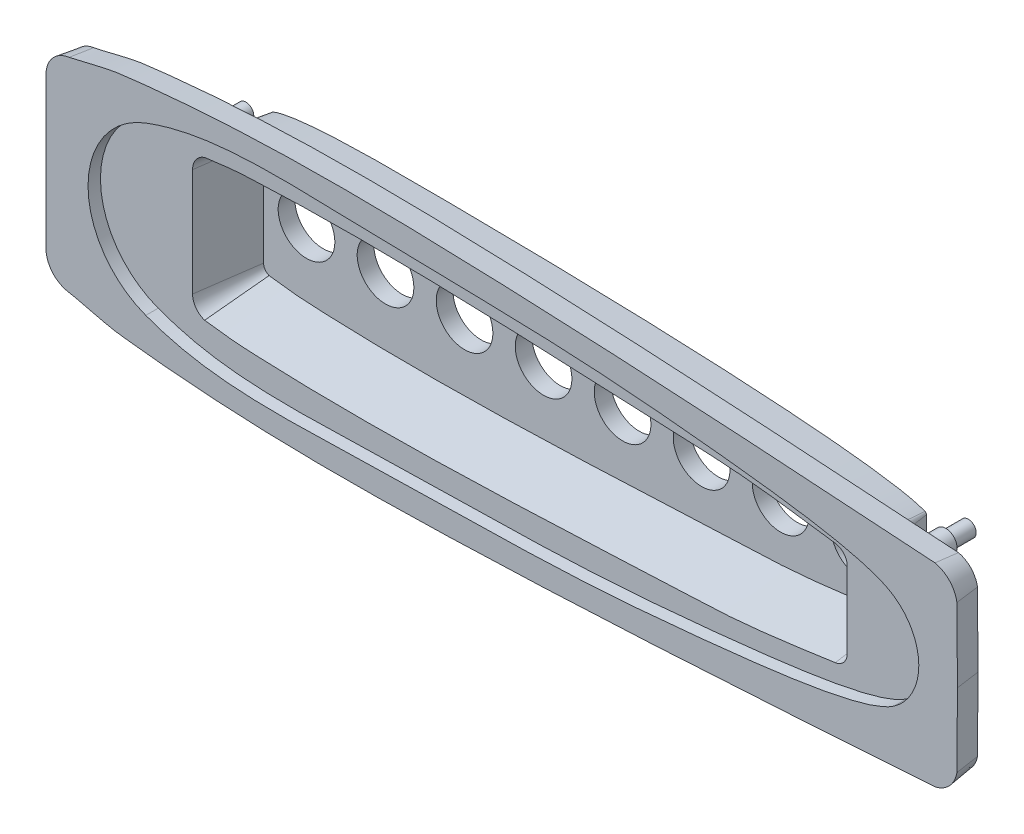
SolidWorks part; units mm, degrees
ref_plane "Plan de face" through (0, 0, 0) normal (0, 0, 1) x (1, 0, 0)
ref_plane "Plan de dessus" through (0, 0, 0) normal (0, 1, 0) x (1, 0, 0)
ref_plane "Plan de droite" through (0, 0, 0) normal (1, 0, 0) x (0, 0, -1)
sketch "Esquisse1" plane through (0, 0, 0) normal (0, 0, 1) x (1, 0, 0)
  line L0 (1.2, 0) -> (83.8076, 0) construction
  line L1 (1.2, -7) -> (1.2, 7) construction
  line L2 (81.3463, 0) -> (81.3, 6.5)
  line L3 (1.2, -6.7987) -> (1.2, 6.7987)
  line L4 (81.3463, 0) -> (81.3, -6.5)
  arc A0 (81.3, 6.5) -> (79.6134, 8.2964) centre (79.1226, 6.1457) ccw
  arc A1 (2.9981, 8.7297) -> (1.2, 6.7987) centre (3.2763, 6.668) ccw
  arc A2 (2.9981, -8.7297) -> (1.2, -6.7987) centre (3.2763, -6.668) cw
  arc A3 (81.3, -6.5) -> (79.6134, -8.2964) centre (79.1226, -6.1457) cw
  spline S0 degree 3 poles (1.6002, 8.1316) (1.6425, 8.1642) (1.6871, 8.1908) (1.7767, 8.2424) (1.8222, 8.2666) (1.9598, 8.3361) (2.053, 8.3785) (2.3351, 8.4991) (2.5266, 8.5705) (3.1064, 8.7707) (3.5007, 8.8851) (4.692, 9.1974) (5.4926, 9.3631) (7.904, 9.7971) (9.5247, 10.0003) (12.7791, 10.3205) (14.4124, 10.4343) (17.675, 10.599) (19.3063, 10.6497) (22.5693, 10.7034) (24.2008, 10.7009) (27.4639, 10.6963) (29.0955, 10.6909) (33.9903, 10.6642) (37.2535, 10.6324) (43.7801, 10.5253) (47.044, 10.4504) (53.5692, 10.2289) (56.83, 10.0818) (61.7167, 9.7726) (63.345, 9.6545) (66.5994, 9.39) (68.2254, 9.2434) (71.477, 8.945) (73.1027, 8.7945) (76.3565, 8.5219) (77.9845, 8.3999) (79.6142, 8.2964) knots 0 0 0 0 0.001953 0.001953 0.003906 0.003906 0.007813 0.007813 0.015625 0.015625 0.03125 0.03125 0.0625 0.0625 0.125 0.125 0.1875 0.1875 0.25 0.25 0.3125 0.3125 0.375 0.375 0.5 0.5 0.625 0.625 0.75 0.75 0.8125 0.8125 0.875 0.875 0.9375 0.9375 1 1 1 1 construction
  spline S1 degree 3 poles (79.6134, 8.2964) (65.4366, 9.2448) (41.3608, 10.8555) (17.7967, 10.977) (6.0247, 9.5322) (3.6821, 8.8221) (2.9981, 8.7297) knots 0 0 0 0 0.552308 0.937959 0.937959 1 1 1 1
  spline S2 degree 3 poles (79.6134, -8.2964) (65.4366, -9.2448) (41.3608, -10.8555) (17.7967, -10.977) (6.0247, -9.5322) (3.6821, -8.8221) (2.9981, -8.7297) knots 0 0 0 0 0.552308 0.937959 0.937959 1 1 1 1
extrude "Extrusion1" add sketch "Esquisse1" along normal blind 2.12 draft 8
sketch "Esquisse2" plane through (0, 0, 2.12) normal (0, 0, 1) x (1, 0, 0)
  line L0 (0, 0) -> (82.0158, 0) construction
  arc A0 (9.7406, 7.3783) -> (9.7406, -7.3783) centre (12.5055, 0) ccw
  arc A1 (76.0403, -4.2062) -> (76.0403, 4.2062) centre (73.0791, 0) ccw
  spline S0 degree 3 poles (76.0403, 4.2062) (73.7947, 5.7871) (67.2235, 6.6668) (46.2556, 8.9404) (42.0249, 8.5563) (17.5565, 9.2655) (13.5052, 8.7891) (9.7406, 7.3783) knots 0 0 0 0 0.230471 0.230471 0.77376 0.77376 1 1 1 1
  spline S1 degree 3 poles (76.0403, -4.2062) (73.7947, -5.7871) (67.2235, -6.6668) (46.2556, -8.9404) (42.0249, -8.5563) (17.5565, -9.2655) (13.5052, -8.7891) (9.7406, -7.3783) knots 0 0 0 0 0.230471 0.230471 0.77376 0.77376 1 1 1 1
extrude "Enlèv. mat.-Extru.1" cut sketch "Esquisse2" against normal blind 1.1
sketch "Esquisse3" plane through (0, 0, 1.02) normal (0, 0, 1) x (1, 0, 0)
  line L0 (0.9021, 0) -> (81.6442, 0) construction
  line L1 (0.9021, 6.8077) -> (0.9021, -6.8077) construction
  line L2 (11.783, -5.5412) -> (11.783, 5.5412)
  line L3 (71.783, -3.8004) -> (71.783, 3.8004)
  arc A0 (11.783, 5.5412) -> (12.3401, 6.5544) centre (12.983, 5.5412) cw
  arc A1 (71.783, 3.8004) -> (71.0536, 4.9043) centre (70.583, 3.8004) ccw
  arc A2 (71.783, -3.8004) -> (71.0536, -4.9043) centre (70.583, -3.8004) cw
  arc A3 (11.783, -5.5412) -> (12.3401, -6.5544) centre (12.983, -5.5412) ccw
  spline S0 degree 3 poles (71.0536, 4.9043) (66.9289, 6.6626) (44.7322, 7.6057) (18.7753, 7.6057) (13.6132, 7.3622) (12.3401, 6.5544) knots 0.019438 0.019438 0.019438 0.019438 0.791941 0.791941 0.981652 0.981652 0.981652 0.981652
  spline S1 degree 3 poles (71.0536, -4.9043) (66.9289, -6.6626) (44.7322, -7.6057) (18.7753, -7.6057) (13.6132, -7.3622) (12.3401, -6.5544) knots 0.019438 0.019438 0.019438 0.019438 0.791941 0.791941 0.981652 0.981652 0.981652 0.981652
  point P7 (11.783, 0)
  point P21 (71.783, 0)
  dimension "D2" = 1.2
  dimension "D3" = 60
extrude "Extrusion2" add sketch "Esquisse3" against normal blind 7 draft 8
sketch "Esquisse4" plane through (0, 0, 1.02) normal (0, 0, 1) x (1, 0, 0)
  line L0 (12.783, -4.7705) -> (12.783, 4.7705)
  line L1 (0, 0) -> (81.6442, 0) construction
  line L2 (70.783, -3.3599) -> (70.783, 3.3599)
  arc A0 (12.783, 4.7705) -> (13.8569, 6.2452) centre (14.3323, 4.7705) cw
  arc A1 (70.783, 3.3599) -> (69.7238, 4.582) centre (69.5484, 3.3599) ccw
  arc A3 (70.783, -3.3599) -> (69.7238, -4.582) centre (69.5484, -3.3599) cw
  arc A4 (12.783, -4.7705) -> (13.8569, -6.2452) centre (14.3323, -4.7705) ccw
  spline S0 degree 3 poles (13.8569, 6.2452) (15.0142, 6.3988) (16.1715, 6.5524) (30.4528, 7.3349) (45.5462, 6.3669) (62.0921, 5.6775) (65.908, 5.1297) (69.7238, 4.582) knots 0 0 0 0 0.061282 0.061282 0.799133 0.799133 1 1 1 1
  spline S3 degree 3 poles (13.8569, -6.2452) (15.0142, -6.3988) (16.1715, -6.5524) (30.4528, -7.3349) (45.5462, -6.3669) (62.0921, -5.6775) (65.908, -5.1297) (69.7238, -4.582) knots 0 0 0 0 0.061282 0.061282 0.799133 0.799133 1 1 1 1
  point P9 (12.783, 0)
  point P26 (70.783, 0)
extrude "Enlèv. mat.-Extru.2" cut sketch "Esquisse4" against normal blind 5.52 draft 8
sketch "Esquisse5" plane through (0, 0, -4.5) normal (0, 0, 1) x (1, 0, 0)
  circle A0 centre (17.3603, 0) radius 2.51
  circle A1 centre (24.3603, 0) radius 2.51
  circle A2 centre (31.3603, 0) radius 2.51
  circle A3 centre (38.3603, 0) radius 2.51
  circle A4 centre (45.3603, 0) radius 2.51
  circle A5 centre (52.3603, 0) radius 2.51
  circle A6 centre (59.3603, 0) radius 2.51
  circle A7 centre (66.3603, 0) radius 2.51
  dimension "D1" = 5.02
extrude "Enlèv. mat.-Extru.3" cut sketch "Esquisse5" against normal through all
sketch "Esquisse6" plane through (0, 0, 0) normal (0, 0, -1) x (-1, 0, 0)
  line L0 (0, 0) -> (-88.2454, 0) construction
  circle A0 centre (-9.4885, 3.6) radius 1
  circle A1 centre (-73.4885, 3.6) radius 1
  circle A2 centre (-73.4885, -3.6) radius 1
  circle A3 centre (-9.4885, -3.6) radius 1
  dimension "D2" = 2
  dimension "D1" = 64
  dimension "D3" = 7.2
extrude "Extrusion3" add sketch "Esquisse6" along normal blind 5
sketch "Esquisse7" plane through (0, 0, -5) normal (0, 0, -1) x (-1, 0, 0)
  line L0 (0, 0) -> (-84.0458, 0) construction
  circle A0 centre (-73.4885, 3.6) radius 0.7
  circle A1 centre (-9.4885, 3.6) radius 0.7
  circle A2 centre (-9.4885, 3.6) radius 1 construction
  circle A3 centre (-73.4885, 3.6) radius 1 construction
  circle A4 centre (-9.4885, -3.6) radius 0.7
  circle A5 centre (-73.4885, -3.6) radius 0.7
  dimension "D1" = 1.4
extrude "Extrusion4" add sketch "Esquisse7" along normal blind 2
